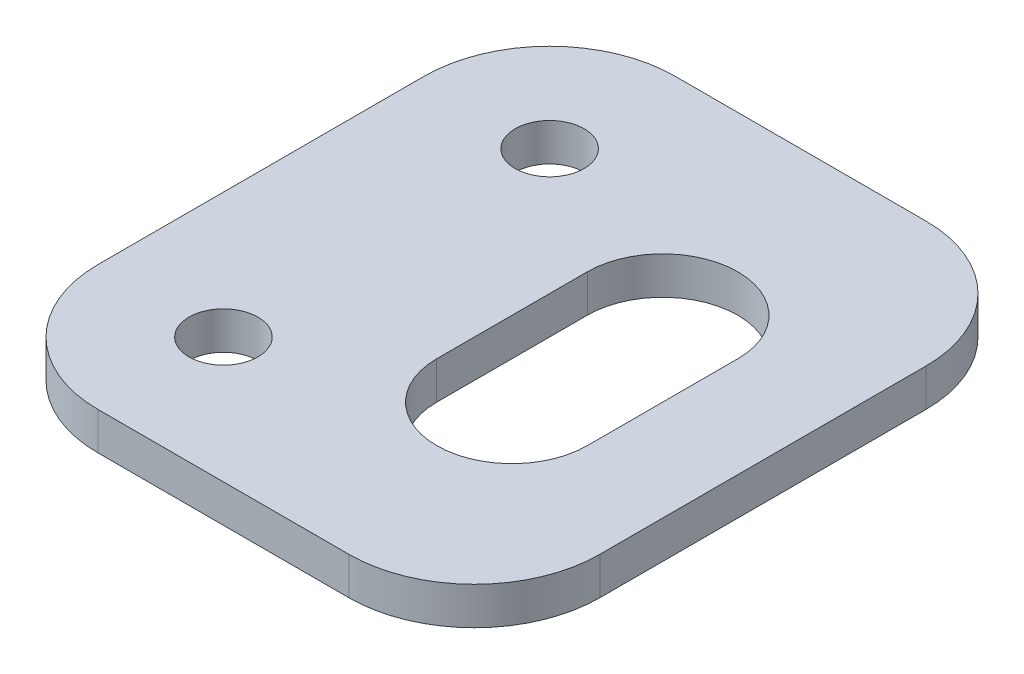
SolidWorks part; units mm, degrees
ref_plane "Front Plane" through (0, 0, 0) normal (0, 0, 1) x (1, 0, 0)
ref_plane "Top Plane" through (0, 0, 0) normal (0, 1, 0) x (1, 0, 0)
ref_plane "Right Plane" through (0, 0, 0) normal (1, 0, 0) x (0, 0, -1)
sketch "Sketch1" plane through (0, 0, 0) normal (0, 1, 0) x (1, 0, 0)
  line L0 (26, 29) -> (26, 17) construction
  line L1 (10, 0) -> (30, 0)
  line L2 (0, 10) -> (0, 36)
  line L3 (10, 46) -> (30, 46)
  line L4 (40, 10) -> (40, 36)
  line L5 (32, 29) -> (32, 17)
  line L6 (20, 29) -> (20, 17)
  circle A0 centre (10, 36) radius 2.75
  circle A1 centre (10, 10) radius 2.75
  arc A2 (32, 29) -> (20, 29) centre (26, 29) ccw
  arc A3 (20, 17) -> (32, 17) centre (26, 17) ccw
  arc A4 (40, 36) -> (30, 46) centre (30, 36) ccw
  arc A5 (30, 0) -> (40, 10) centre (30, 10) ccw
  arc A6 (0, 10) -> (10, 0) centre (10, 10) ccw
  arc A7 (10, 46) -> (0, 36) centre (10, 36) ccw
  point P19 (40, 0)
  point P22 (0, 0)
  point P25 (0, 46)
  point P26 (-50.04, 22.6149)
  dimension "D3" = 5.5
  dimension "D4" = 12
  dimension "D5" = 12
  dimension "D6" = 17
  dimension "D8" = 10
  dimension "D9" = 10
  dimension "D10" = 26
  dimension "D11" = 10
  dimension "D1" = 46
  dimension "D2" = 40
  dimension "D7" = 14
extrude "Extrude1" add sketch "Sketch1" along normal blind 3
